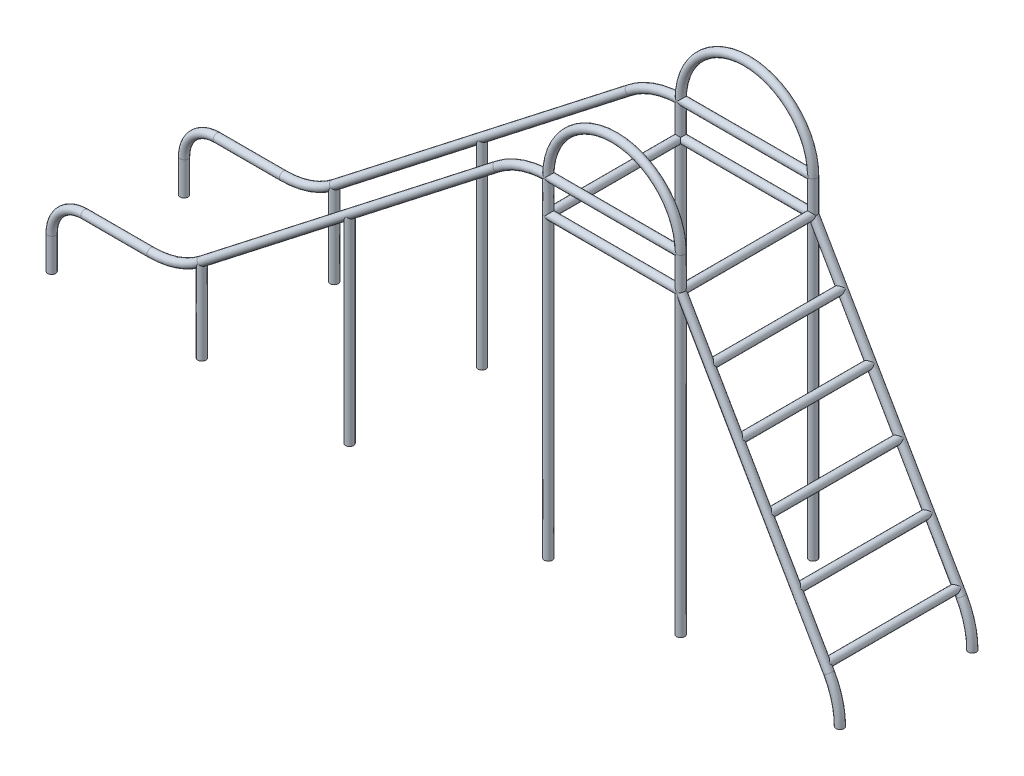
SolidWorks part; units mm, degrees
ref_plane "Front Plane" through (0, 0, 0) normal (0, 0, 1) x (1, 0, 0)
ref_plane "Top Plane" through (0, 0, 0) normal (0, 1, 0) x (1, 0, 0)
ref_plane "Right Plane" through (0, 0, 0) normal (1, 0, 0) x (0, 0, -1)
sketch "Sketch1" plane through (0, 0, 0) normal (0, 0, 1) x (1, 0, 0)
  line L0 (0, 0) -> (0, 1800)
  line L1 (0, 1800) -> (800, 1800)
  line L2 (800, 1800) -> (800, 0)
  line L3 (0, 1800) -> (0, 2000)
  line L4 (800, 1800) -> (800, 2000)
  line L5 (800, 1800) -> (1694.8929, 250)
  line L6 (800, 2000) -> (0, 2000)
  line L7 (-306.9971, 1894.6552) -> (-2093.0029, 505.3448)
  line L8 (-2400, 400) -> (-2800, 400)
  line L9 (-3000, 200) -> (-3000, 0)
  line L10 (-2093.0029, 505.3448) -> (-2093.0029, 0)
  line L11 (-1200, 1200) -> (-1200, 0)
  arc A0 (0, 2000) -> (800, 2000) centre (400, 2000) cw
  arc A1 (1694.8929, 250) -> (1761.8802, 0) centre (1261.8802, 0) cw
  arc A2 (0, 2000) -> (-306.9971, 1894.6552) centre (0, 1500) ccw
  arc A3 (-2093.0029, 505.3448) -> (-2400, 400) centre (-2400, 900) cw
  arc A4 (-2800, 400) -> (-3000, 200) centre (-2800, 200) ccw
  dimension "D5" = 500
  dimension "D8" = 200
  dimension "D10" = 500
  dimension "D11" = 500
  dimension "D1" = 1800
  dimension "D2" = 800
  dimension "D3" = 200
  dimension "D4" = 30
  dimension "D6" = 3000
  dimension "D7" = 200
  dimension "D9" = 400
other "Structural Member1"
ref_plane "Plane1" through (800, 1800, 0) normal (0, -1, 0) x (1, 0, 0)
sketch "Sketch11" plane through (800, 1800, 0) normal (0, -1, 0) x (1, 0, 0)
  circle A0 centre (0, 0) radius 20.447
  circle A1 centre (0, 0) radius 24.13
  circle A2 centre (0, 0) radius 19.05 construction
  point P5 (0, 0)
  dimension "In_dia" = 40.894
  dimension "Out_dia" = 48.26
  dimension "D1" = 38.1
ref_plane "Plane2" through (0, 0, -400) normal (0, 0, 1) x (1, 0, 0)
mirror "Mirror1" about plane through (0, 0, -400) normal (0, 0, 1)
sketch3d "3DSketch1"
  line L0 (0, 1800, 0) -> (0, 1800, -800)
  line L1 (800, 1800, 0) -> (800, 1800, -800)
  line L2 (0, 1800, -800) -> (800, 1800, -800)
  dimension "D1" = 800
other "Structural Member2"
ref_plane "Plane3" through (0, 1800, 0) normal (1, 0, 0) x (0, 1, 0)
sketch "Sketch12" plane through (0, 1800, 0) normal (1, 0, 0) x (0, 1, 0)
  circle A0 centre (0, 0) radius 20.447
  circle A1 centre (0, 0) radius 24.13
  circle A2 centre (0, 0) radius 19.05 construction
  point P5 (0, 0)
  dimension "In_dia" = 40.894
  dimension "Out_dia" = 48.26
  dimension "D1" = 38.1
other "Trim/Extend1"
sketch3d "3DSketch2"
  line L0 (975, 1496.8911, 0) -> (975, 1496.8911, -800)
  line L1 (800, 1800, 0) -> (1694.8929, 250, 0) construction
  line L2 (800, 1800, 0) -> (800, 1800, -800) construction
  dimension "D1" = 800
  dimension "D2" = 350
other "Structural Member3"
ref_plane "Plane4" through (975, 1496.8911, 0) normal (0, 0, -1) x (1, 0, 0)
sketch "Sketch13" plane through (975, 1496.8911, 0) normal (0, 0, -1) x (1, 0, 0)
  circle A0 centre (0, 0) radius 20.447
  circle A1 centre (0, 0) radius 24.13
  circle A2 centre (0, 0) radius 19.05 construction
  point P5 (0, 0)
  dimension "In_dia" = 40.894
  dimension "Out_dia" = 48.26
  dimension "D1" = 38.1
other "Trim/Extend2"
pattern_linear "LPattern1" count 5 spacing 350 along (0.5, -0.866, 0)
